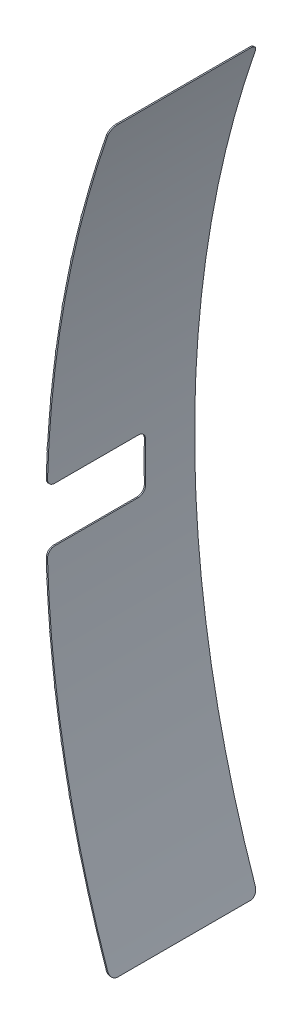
SolidWorks part; units mm, degrees
ref_plane "前视基准面" through (0, 0, 0) normal (0, 0, 1) x (1, 0, 0)
ref_plane "上视基准面" through (0, 0, 0) normal (0, 1, 0) x (1, 0, 0)
ref_plane "右视基准面" through (0, 0, 0) normal (1, 0, 0) x (0, 0, -1)
sketch "草图1" plane through (0, 0, 0) normal (0, 0, 1) x (1, 0, 0)
  line L0 (-42.5325, 15) -> (-42.4794, 15)
  line L1 (-42.5325, -15) -> (-42.4794, -15)
  line L2 (-1000, 0) -> (49000, 0) construction
  arc A0 (-42.5325, 15) -> (-42.5325, -15) centre (0, 0) ccw
  arc A1 (-42.4794, 15) -> (-42.4794, -15) centre (0, 0) ccw
  dimension "D1" = 90.2
  dimension "D2" = 90.1
  dimension "D3" = 30
extrude "凸台-拉伸1" add sketch "草图1" along normal blind 6
ref_plane "基准面1" through (-50, 0, 0) normal (1, 0, 0) x (0, 0, -1)
sketch "草图4" plane through (0, 0, 0) normal (1, 0, 0) x (0, 0, -1)
  line L0 (-6, -1.1) -> (-2, -1.1)
  line L1 (-6, 15) -> (-6, -15) construction
  line L2 (-2, -1.1) -> (-2, 1.1)
  line L3 (-2, 1.1) -> (-6, 1.1)
  line L4 (-6, 1.1) -> (-6, -1.1)
  line L5 (-1000, 0) -> (49000, 0) construction
  dimension "D1" = 4
  dimension "D2" = 2.2
extrude "切除-拉伸1" cut sketch "草图4" against normal through all
fillet "圆角1" radius 0.3 8 edges at (-42.5059, -15, 6) (-42.5059, -15, 0) (-42.5059, 15, 6) (-42.5059, 15, 0) (-45.0616, -1.1, 2) (-45.0616, 1.1, 2) (-45.0616, 1.1, 6) (-45.0616, -1.1, 6)
sketch "草图5" plane through (-50, 0, 0) normal (1, 0, 0) x (0, 0, -1)
  line L0 (0, -2.8572) -> (0, 3.1428)
  line L1 (0, 3.1428) -> (-2, 0.1428)
  line L2 (-2, 0.1428) -> (0, -2.8572)
  line L3 (-1002, 0.1428) -> (48998, 0.1428) construction
  line L4 (0, -14.7) -> (0, 14.7) construction
  line L5 (-2, 0.8) -> (-2, -0.8) construction
  line L6 (-6, -1.4) -> (-6, -14.7) construction
  line L7 (-6, -2.3) -> (-2, -2.3)
  line L8 (-6, -2.3) -> (-6, -2.1)
  line L9 (-6, -2.1) -> (-2, -2.1)
  line L10 (-2, -2.3) -> (-2, -2.1)
  line L31 (-5.7, -1.1) -> (-2.3, -1.1) construction
  line L56 (-6, -4.1) -> (-2, -4.1)
  line L57 (-6, -4.1) -> (-6, -3.9)
  line L58 (-6, -3.9) -> (-2, -3.9)
  line L59 (-2, -4.1) -> (-2, -3.9)
  line L60 (-6, -5.9) -> (-2, -5.9)
  line L61 (-6, -5.9) -> (-6, -5.7)
  line L62 (-6, -5.7) -> (-2, -5.7)
  line L63 (-2, -5.9) -> (-2, -5.7)
  line L64 (-6, -7.7) -> (-2, -7.7)
  line L65 (-6, -7.7) -> (-6, -7.5)
  line L66 (-6, -7.5) -> (-2, -7.5)
  line L67 (-2, -7.7) -> (-2, -7.5)
  line L68 (-6, -9.5) -> (-2, -9.5)
  line L69 (-6, -9.5) -> (-6, -9.3)
  line L70 (-6, -9.3) -> (-2, -9.3)
  line L71 (-2, -9.5) -> (-2, -9.3)
  line L72 (-6, -11.3) -> (-2, -11.3)
  line L73 (-6, -11.3) -> (-6, -11.1)
  line L74 (-6, -11.1) -> (-2, -11.1)
  line L75 (-2, -11.3) -> (-2, -11.1)
  line L76 (-6, -2.3) -> (-6, -4.1) construction
  line L77 (-6, 2.5855) -> (-6, 4.3855) construction
  line L78 (-2, 11.5855) -> (-2, 11.3855)
  line L79 (-6, 11.3855) -> (-2, 11.3855)
  line L80 (-6, 11.5855) -> (-6, 11.3855)
  line L81 (-6, 11.5855) -> (-2, 11.5855)
  line L82 (-2, 9.7855) -> (-2, 9.5855)
  line L83 (-6, 9.5855) -> (-2, 9.5855)
  line L84 (-6, 9.7855) -> (-6, 9.5855)
  line L85 (-6, 9.7855) -> (-2, 9.7855)
  line L86 (-2, 7.9855) -> (-2, 7.7855)
  line L87 (-6, 7.7855) -> (-2, 7.7855)
  line L88 (-6, 7.9855) -> (-6, 7.7855)
  line L89 (-6, 7.9855) -> (-2, 7.9855)
  line L90 (-2, 6.1855) -> (-2, 5.9855)
  line L91 (-6, 5.9855) -> (-2, 5.9855)
  line L92 (-6, 6.1855) -> (-6, 5.9855)
  line L93 (-6, 6.1855) -> (-2, 6.1855)
  line L94 (-2, 4.3855) -> (-2, 4.1855)
  line L95 (-6, 4.1855) -> (-2, 4.1855)
  line L96 (-6, 4.3855) -> (-6, 4.1855)
  line L97 (-6, 4.3855) -> (-2, 4.3855)
  line L98 (-2, 2.5855) -> (-2, 2.3855)
  line L99 (-6, 2.3855) -> (-2, 2.3855)
  line L100 (-6, 2.5855) -> (-6, 2.3855)
  line L101 (-6, 2.5855) -> (-2, 2.5855)
  line L102 (-5.7, -15) -> (-0.3, -15) construction
  line L103 (-4.5, -13.3) -> (-3.1, -13.3)
  line L104 (-4.5, -13.3) -> (-4.5, -13.5)
  line L105 (-4.5, -13.5) -> (-3.1, -13.5)
  line L106 (-1.5, -13.3) -> (-1.5, -13.5)
  line L107 (-6, 14.7) -> (-6, 1.4) construction
  line L108 (-3.1, -11.9) -> (-2.9, -11.9)
  line L109 (-3.1, -11.9) -> (-3.1, -13.3)
  line L110 (-3.1, -14.9) -> (-2.9, -14.9)
  line L111 (-2.9, -11.9) -> (-2.9, -13.3)
  line L112 (-3.1, 14.8573) -> (-2.9, 14.8573)
  line L113 (-3.1, 14.8573) -> (-3.1, 11.8573)
  line L114 (-3.1, 11.8573) -> (-2.9, 11.8573)
  line L115 (-2.9, 14.8573) -> (-2.9, 11.8573)
  line L116 (-2.9, -13.3) -> (-1.5, -13.3)
  line L117 (-2.9, -13.5) -> (-1.5, -13.5)
  line L118 (-3.1, -13.5) -> (-3.1, -14.9)
  line L119 (-2.9, -13.5) -> (-2.9, -14.9)
  point P77 (-3, 11.8573)
  dimension "D1" = 6
  dimension "D2" = 0.2
  dimension "D3" = 6
  dimension "D5" = 1
  dimension "D4" = 1.8
  dimension "D6" = 3
  dimension "D7" = 0.2
  dimension "D8" = 1.5
  dimension "D9" = 1.5
  dimension "D10" = 3
  dimension "D11" = 0.2
  dimension "D12" = 1.4
  dimension "D13" = 1.4
  dimension "D14" = 3
  dimension "D15" = 0.1
  dimension "D16" = 2.9
wrap "包覆1" sketch "草图5" wrap type emboss source sketch "草图5" thickness 0.01 parameters "D1"=0.01
